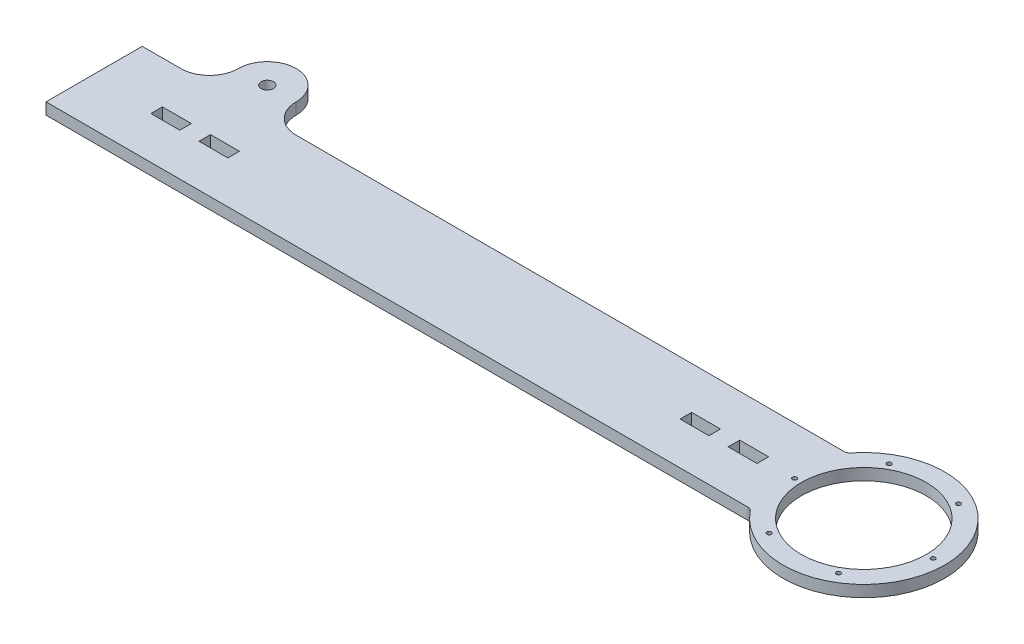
SolidWorks part; units mm, degrees
ref_plane "Front" through (0, 0, 0) normal (0, 0, 1) x (1, 0, 0)
ref_plane "Top" through (0, 0, 0) normal (0, 1, 0) x (1, 0, 0)
ref_plane "Right" through (0, 0, 0) normal (1, 0, 0) x (0, 0, -1)
sketch "Sketch1" plane through (0, 0, 0) normal (0, 1, 0) x (1, 0, 0)
  line L0 (0, 0) -> (-400, 0) construction
  line L1 (-400, 25) -> (-400, -25)
  line L2 (-400, -25) -> (-33.7491, -25)
  line L3 (-400, 25) -> (-33.7491, 25)
  arc A0 (-33.7491, 25) -> (-33.7491, -25) centre (0, 0) cw
  dimension "D1" = 42
  dimension "D2" = 50
  dimension "D3" = 400
extrude "Boss-Extrude1" add sketch "Sketch1" along normal blind 6
sketch "Sketch2" plane through (0, 6, 0) normal (0, 1, 0) x (1, 0, 0)
  circle A0 centre (0, 0) radius 32.45
  dimension "D1" = 64.9
extrude "bearing bore" cut sketch "Sketch2" against normal through all
sketch "Sketch3" plane through (0, 6, 0) normal (0, 1, 0) x (1, 0, 0)
  line L0 (0, 0) -> (-400, 0) construction
  line L1 (-400, 25) -> (-400, -25) construction
  line L2 (0, 0) -> (0, 20.3128) construction
  point P5 (-148.6868, -9.7246)
  point P6 (-378.7375, -3)
  line B0 (-92.5, -3) -> (-77.5, -3)
  line B1 (-77.5, -3) -> (-77.5, 3)
  line B2 (-77.5, 3) -> (-92.5, 3)
  line B3 (-92.5, 3) -> (-92.5, -3)
  line B4 (-92.5, 0) -> (-77.5, 0) construction
  line B5 (-85, 3) -> (-85, -3) construction
  line B6 (-67.5, -3) -> (-52.5, -3)
  line B7 (-52.5, -3) -> (-52.5, 3)
  line B8 (-52.5, 3) -> (-67.5, 3)
  line B9 (-67.5, 3) -> (-67.5, -3)
  line B10 (-67.5, 0) -> (-52.5, 0) construction
  line B11 (-60, 3) -> (-60, -3) construction
  line B12 (-342.5, -3) -> (-327.5, -3)
  line B13 (-327.5, -3) -> (-327.5, 3)
  line B14 (-327.5, 3) -> (-342.5, 3)
  line B15 (-342.5, 3) -> (-342.5, -3)
  line B16 (-342.5, 0) -> (-327.5, 0) construction
  line B17 (-335, 3) -> (-335, -3) construction
  line B18 (-367.5, -3) -> (-352.5, -3)
  line B19 (-352.5, -3) -> (-352.5, 3)
  line B20 (-352.5, 3) -> (-367.5, 3)
  line B21 (-367.5, 3) -> (-367.5, -3)
  line B22 (-367.5, 0) -> (-352.5, 0) construction
  line B23 (-360, 3) -> (-360, -3) construction
  dimension "D1" = 25
  dimension "D2" = 60
  dimension "D3" = 25
  dimension "D4" = 335
sketch_block_instance "Block-laser-cut-slot-15x6-1"
sketch_block "Block-laser-cut-slot-15x6" parameters "D1"=15, "D2"=6
sketch_block_instance "Block-laser-cut-slot-15x6-2"
sketch_block_instance "Block-laser-cut-slot-15x6-3"
sketch_block_instance "Block-laser-cut-slot-15x6-4"
extrude "web slots" cut sketch "Sketch3" against normal up to next
sketch "Sketch4" plane through (0, 6, 0) normal (0, 1, 0) x (1, 0, 0)
  line L0 (0, 0) -> (36, 0) construction
  circle A0 centre (36, 0) radius 1.1303
  dimension "D2" = 2.2606
  dimension "D1" = 36
extrude "screw hole" cut sketch "Sketch4" against normal up to next and the other way through all
pattern_circular "screw pattern" count 6 over 360 about axis through (0, 0, 0) along (0, 1, 0) of "screw hole"
fillet "Fillet1" radius 3 2 edges at (-33.7491, 3, -25) (-33.7491, 3, 25)
sketch "Sketch5" plane through (0, 6, 0) normal (0, 1, 0) x (1, 0, 0)
  line L0 (-35.2278, 25) -> (-400, 25) construction
  line L1 (0, 0) -> (-384.8842, 0) construction
  line L2 (-380, 25) -> (-320, 25)
  line L3 (0, 0) -> (0, 72.5827) construction
  circle A0 centre (-350, 40) radius 3.175
  arc A1 (-365, 40) -> (-335, 40) centre (-350, 40) cw
  arc A2 (-335, 40) -> (-320, 25) centre (-320, 40) ccw
  arc A3 (-365, 40) -> (-380, 25) centre (-380, 40) cw
  dimension "D1" = 6.35
  dimension "D2" = 15
  dimension "D3" = 40
  dimension "D4" = 350
extrude "Boss-Extrude2" add sketch "Sketch5" against normal up to surface (6 mm away)
